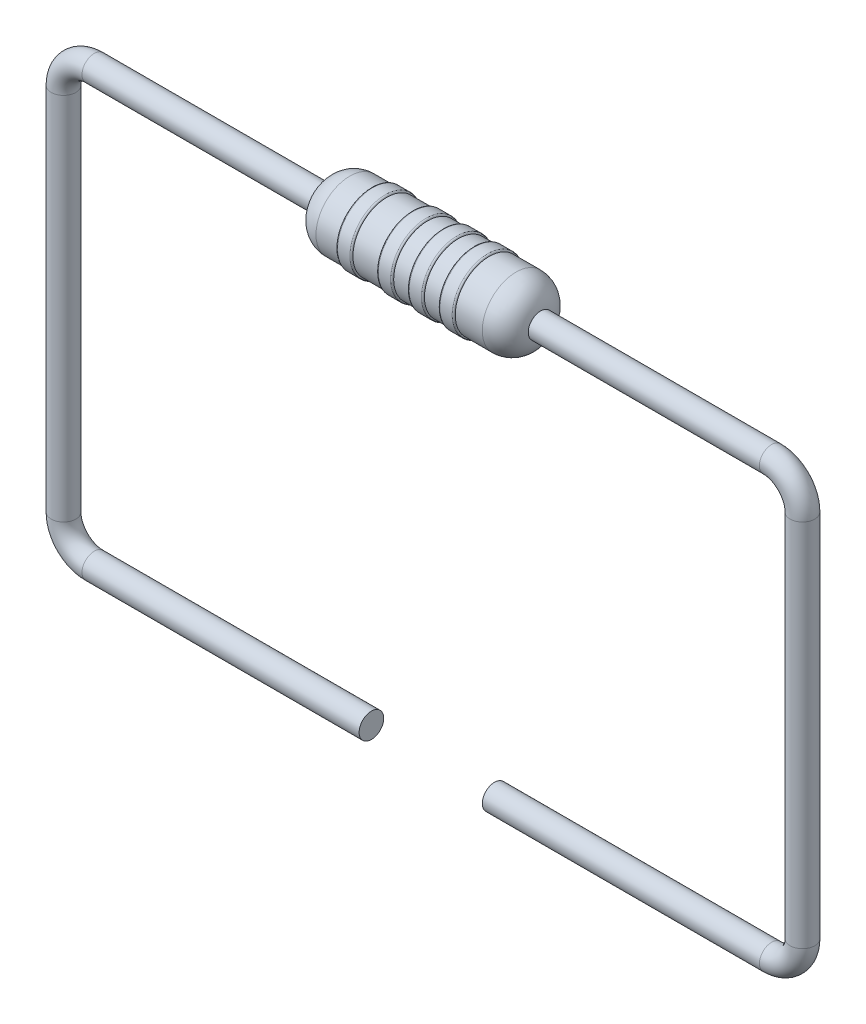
SolidWorks part; units mm, degrees
ref_plane "Face" through (0, 0, 0) normal (0, 0, 1) x (1, 0, 0)
ref_plane "Dessus" through (0, 0, 0) normal (0, 1, 0) x (1, 0, 0)
ref_plane "Droite" through (0, 0, 0) normal (1, 0, 0) x (0, 0, -1)
sketch "Esquisse1" plane through (0, 0, 0) normal (0, 0, 1) x (1, 0, 0)
  line L0 (-54.2687, 0) -> (62.1733, 0) construction
  line L1 (-48.4922, 1.1) -> (45.7559, 1.1) construction
  line L2 (-3.5, -1.6411) -> (-3.5, 4.3175) construction
  line L3 (0, -1.0268) -> (0, 4.1947) construction
  line L4 (3.5, 3.6009) -> (3.5, -1.9687) construction
  line L5 (-3.5, 0) -> (-3.5, 0.3)
  line L6 (-2.7, 1.1) -> (2.7, 1.1)
  line L7 (3.5, 0.3) -> (3.5, 0)
  line L8 (3.5, 0) -> (-3.5, 0)
  arc A0 (-2.7, 1.1) -> (-3.5, 0.3) centre (-2.7, 0.3) ccw
  arc A1 (3.5, 0.3) -> (2.7, 1.1) centre (2.7, 0.3) ccw
revolve "Base-Révolution" add sketch "Esquisse1" angle 360 about L0
sketch "Esquisse2" plane through (0, 0, 0) normal (0, 0, 1) x (1, 0, 0)
  line L0 (-3.3896, 1.15) -> (3.161, 1.15) construction
  line L1 (-2, 1.3889) -> (-2, -0.1179) construction
  line L2 (-1.5, 1.4925) -> (-1.5, -0.2136) construction
  line L3 (4.3262, 0) -> (-3.8651, 0) construction
  line L4 (1.323, 0) -> (1.823, 0)
  line L5 (0.323, 0) -> (0.823, 0)
  line L6 (-0.677, 1.15) -> (-0.677, 0)
  line L7 (0.323, 1.15) -> (0.323, 0)
  line L8 (1.323, 1.15) -> (1.323, 0)
  line L9 (-0.177, 1.15) -> (-0.177, 0)
  line L10 (0.823, 1.15) -> (0.823, 0)
  line L11 (1.823, 1.15) -> (1.823, 0)
  line L12 (-0.677, 0) -> (-0.177, 0)
  line L13 (-0.677, 1.15) -> (-0.177, 1.15)
  line L14 (0.323, 1.15) -> (0.823, 1.15)
  line L15 (1.323, 1.15) -> (1.823, 1.15)
  line L16 (-2, 1.15) -> (-1.5, 1.15)
  line L17 (-1.5, 1.15) -> (-1.5, 0)
  line L18 (-1.5, 0) -> (-2, 0)
  line L19 (-2, 0) -> (-2, 1.15)
revolve "Boss.-Révol.1" add sketch "Esquisse2" angle 360 about L3
fillet "Congé1" radius 0.05 8 edges at (-0.177, 0, -1.15) (-0.677, 0, -1.15) (0.823, 0, -1.15) (0.323, 0, -1.15) (1.823, 0, -1.15) (1.323, 0, -1.15) (-1.5, 0, -1.15) (-2, 0, -1.15)
sketch "Esquisse4" plane through (0, 0, 0) normal (0, 0, 1) x (1, 0, 0)
  line L0 (-11, 0) -> (11, 0)
  line L1 (11, -14) -> (2, -14)
  line L2 (-12, -1) -> (-12, -13)
  line L3 (-11, -14) -> (-2, -14)
  line L4 (0, 0) -> (3.5, 0) construction
  line L5 (3.5, -0.3) -> (3.5, 0.3) construction
  line L6 (0, 0) -> (0, -5.6417) construction
  line L7 (12, -1) -> (12, -13)
  arc A0 (-12, -13) -> (-11, -14) centre (-11, -13) ccw
  arc A1 (-11, 0) -> (-12, -1) centre (-11, -1) ccw
  arc A2 (12, -13) -> (11, -14) centre (11, -13) cw
  arc A3 (11, 0) -> (12, -1) centre (11, -1) cw
  dimension "D1" = 1
  dimension "D2" = 12
  dimension "D3" = 14
  dimension "D4" = 10
ref_plane "Plan1" through (-2, 0, 0) normal (1, 0, 0) x (0, 0, -1)
sketch "Esquisse5" plane through (-2, 0, 0) normal (1, 0, 0) x (0, 0, -1)
  line L0 (0, -13) -> (0, -14) construction
  circle A0 centre (0, -14) radius 0.4
  dimension "D1" = 0.8
sweep "Balayage1" add profiles "Esquisse5" path "Esquisse4"
